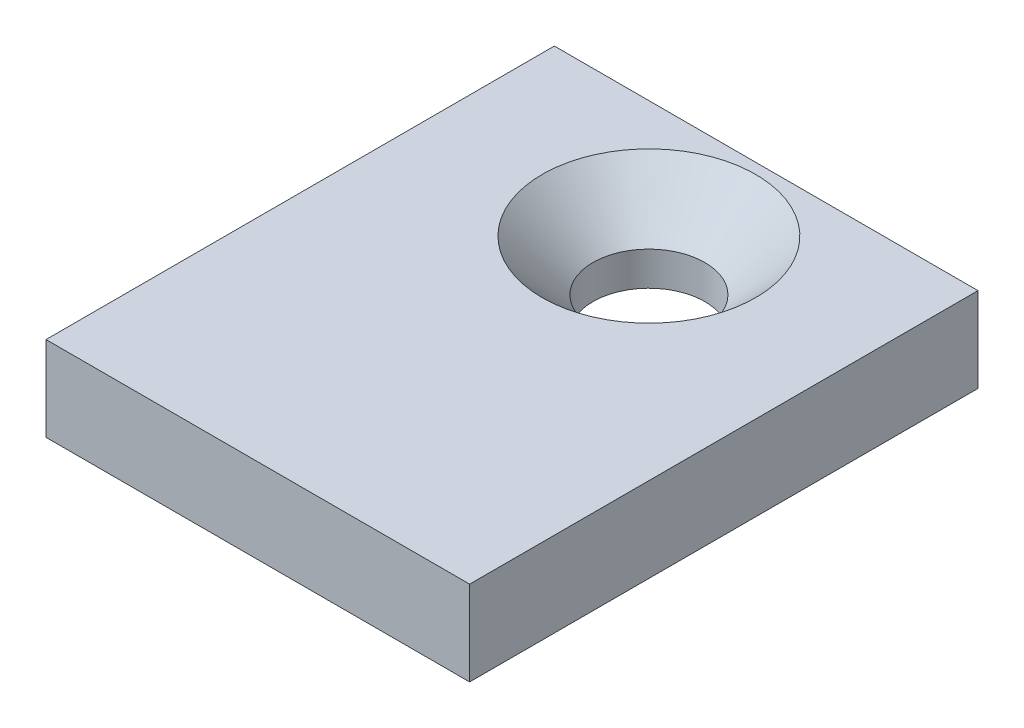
SolidWorks part; units mm, degrees
ref_plane "Plan de face" through (0, 0, 0) normal (0, 0, 1) x (1, 0, 0)
ref_plane "Plan de dessus" through (0, 0, 0) normal (0, 1, 0) x (1, 0, 0)
ref_plane "Plan de droite" through (0, 0, 0) normal (1, 0, 0) x (0, 0, -1)
sketch "Esquisse1" plane through (0, 0, 0) normal (0, 0, 1) x (1, 0, 0)
  line L0 (5.2081, -0.1929) -> (30.2081, -0.1929)
  line L1 (30.2081, -0.1929) -> (30.2081, 4.8071)
  line L2 (30.2081, 4.8071) -> (5.2081, 4.8071)
  line L3 (5.2081, 4.8071) -> (5.2081, -0.1929)
  dimension "D1" = 25
  dimension "D2" = 5
extrude "Boss.-Extru.1" add sketch "Esquisse1" along normal blind 30
sketch "Esquisse3" plane through (0, 4.8071, 0) normal (0, 1, 0) x (1, 0, 0)
  point P1 (17.7081, -6.9203)
hole_wizard "Fraisage pour vis à tête fraisée M61" positions "Esquisse4" profile "Esquisse5" countersink size "M6" standard "ISO"
sketch "Esquisse4" plane through (0, 4.8071, 0) normal (0, 1, 0) x (1, 0, 0)
  point P0 (17.7081, -6.9203)
sketch "Esquisse5" plane through (17.7081, 4.8071, 6.9203) normal (1, 0, 0) x (0, 0, 1)
  line L0 (0, 0) -> (0, 5)
  line L1 (0, 5) -> (3.3, 5)
  line L2 (3.3, 5) -> (3.3, 3)
  line L3 (3.3, 3) -> (6.3, 0)
  line L5 (6.3, 0) -> (0, 0)
  line L6 (-3.3, 3) -> (-6.3, 0) construction
  line L11 (0, -6.35) -> (0, 107.95) construction
  dimension "Diamètre du perçage jusqu'au prochain" = 6.6
  dimension "Profondeur du perçage jusqu'au prochain" = 5
  dimension "Diamètre du fraisage entrant" = 12.6
  dimension "Angle du fraisage entrant" = 90
